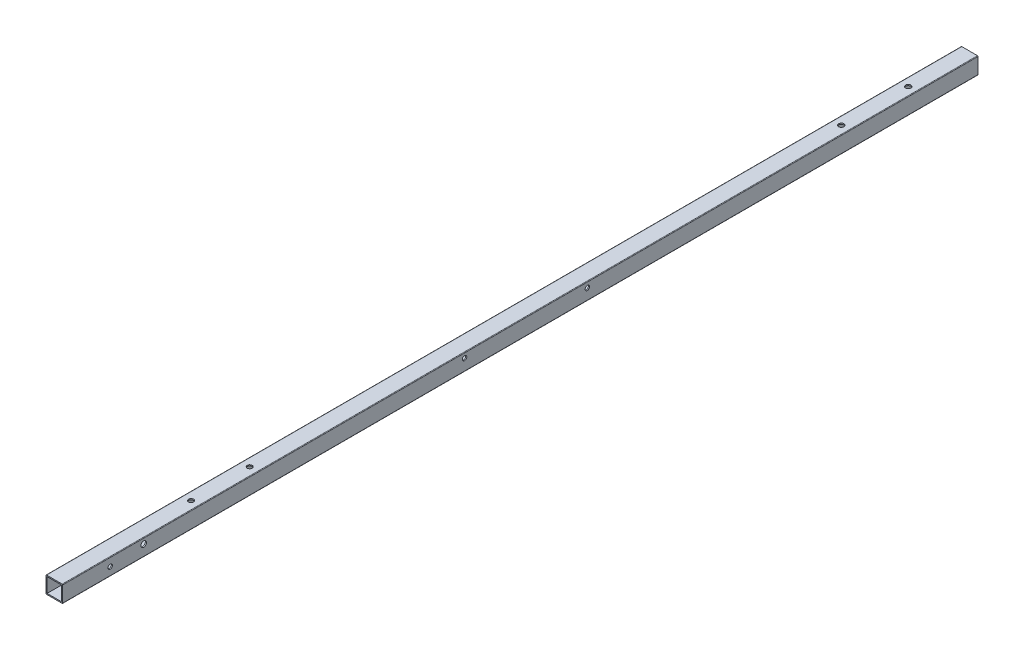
SolidWorks part; units mm, degrees
ref_plane "Plan1" through (0, 0, 0) normal (0, 0, 1) x (1, 0, 0)
ref_plane "Plan2" through (0, 0, 0) normal (0, 1, 0) x (1, 0, 0)
ref_plane "Plan3" through (0, 0, 0) normal (1, 0, 0) x (0, 0, -1)
sketch "Esquisse1" plane through (0, 0, 0) normal (0, 0, 1) x (1, 0, 0)
  line L0 (-14, 15) -> (14, 15)
  line L1 (-15, 14) -> (-15, -14)
  line L2 (14, -15) -> (-14, -15)
  line L3 (15, -14) -> (15, 14)
  line L4 (14, 14) -> (-14, -14) construction
  arc A0 (-14, -15) -> (-15, -14) centre (-14, -14) cw
  arc A1 (-15, 14) -> (-14, 15) centre (-14, 14) cw
  arc A2 (15, 14) -> (14, 15) centre (14, 14) ccw
  arc A3 (15, -14) -> (14, -15) centre (14, -14) cw
  dimension "D1" = 1
  dimension "D2" = 30
extrude "Base-Extru.-Mince" add sketch "Esquisse1" along normal blind 1640 thin
sketch "Esquisse7" plane through (0, 15, 0) normal (0, 1, 0) x (-1, 0, 0)
  line L0 (15, 1640) -> (15, 0) construction
  line L1 (14, 1640) -> (-14, 1640) construction
  circle A0 centre (0, 110) radius 4.75
  circle A1 centre (0, 230) radius 4.75
  circle A2 centre (0, 1290) radius 4.5
  circle A3 centre (0, 1395) radius 4.5
  dimension "D2" = 9.5
  dimension "D5" = 350
  dimension "D6" = 9
  dimension "D7" = 105
  dimension "D1" = 120
  dimension "D3" = 15
  dimension "D4" = 110
extrude "Enlèv. mat.-Extru.6" cut sketch "Esquisse7" against normal blind 35
sketch "Esquisse8" plane through (-15, 0, 0) normal (-1, 0, 0) x (0, 0, 1)
  line L0 (1640, 15) -> (0, 15) construction
  line L1 (1640, 15) -> (0, 15) construction
  line L2 (1640, 14) -> (1640, -14) construction
  line L3 (1640, 15) -> (0, 15) construction
  circle A0 centre (1555, 0) radius 4
  circle A1 centre (1495, 5) radius 5
  circle A2 centre (700.0023, 5) radius 4
  circle A3 centre (920, 6) radius 4
  dimension "D1" = 8
  dimension "D4" = 10
  dimension "D2" = 15
  dimension "D3" = 85
  dimension "D5" = 60
  dimension "D6" = 10
  dimension "D7" = 220
  dimension "D8" = 10
  dimension "D9" = 575
extrude "Enlèv. mat.-Extru.7" cut sketch "Esquisse8" against normal blind 31
sketch "Esquisse9" plane through (0, -15, 0) normal (0, 1, 0) x (-1, 0, 0)
  circle A0 centre (0, 150) radius 4.75
  circle A1 centre (0, 190) radius 4.75
  circle A2 centre (0, 110) radius 4.75 construction
  dimension "D1" = 9.5
  dimension "D2" = 40
  dimension "D3" = 40
extrude "Enlèv. mat.-Extru.8" cut sketch "Esquisse9" along normal blind 10
